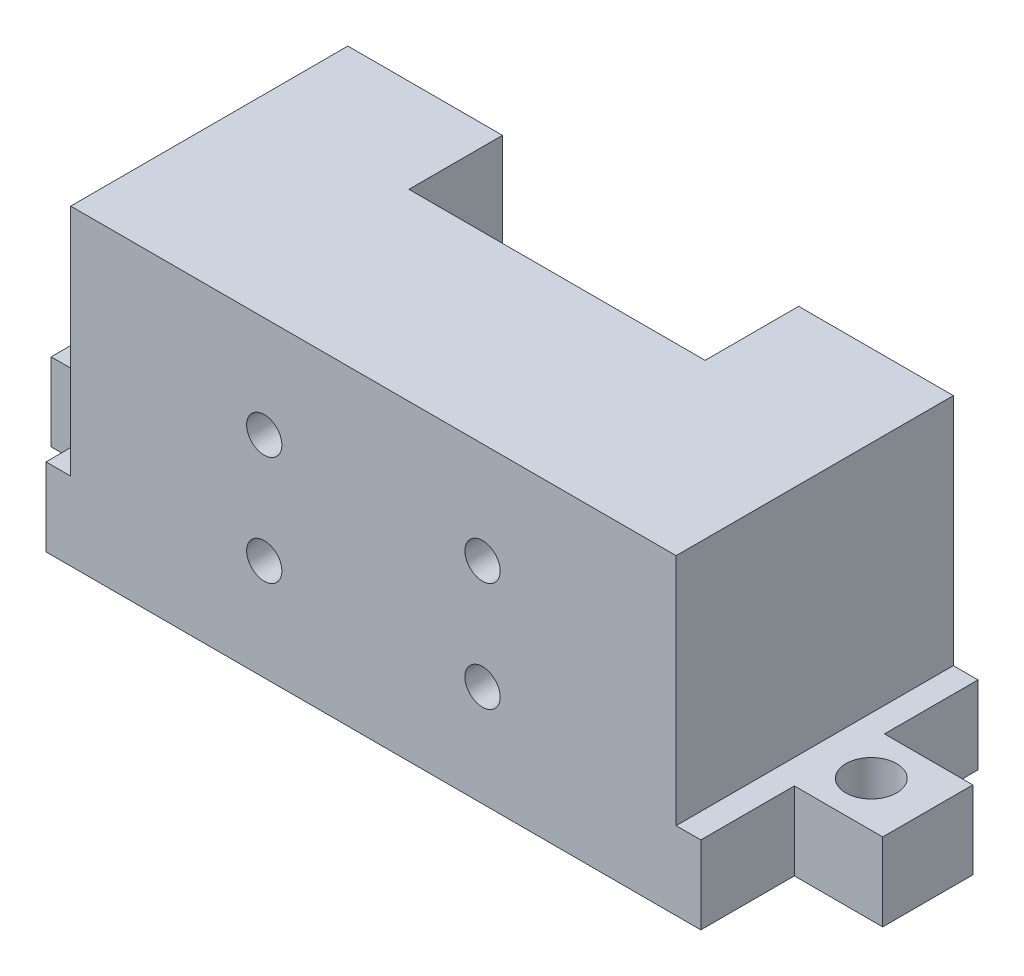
SolidWorks part; units mm, degrees
ref_plane "Front Plane" through (0, 0, 0) normal (0, 0, 1) x (1, 0, 0)
ref_plane "Top Plane" through (0, 0, 0) normal (0, 1, 0) x (1, 0, 0)
ref_plane "Right Plane" through (0, 0, 0) normal (1, 0, 0) x (0, 0, -1)
sketch "Sketch1" plane through (0, 0, 0) normal (0, 1, 0) x (1, 0, 0)
  line L1 (0, 0) -> (53.34, 0)
  line L2 (0, 0) -> (0, 17.78)
  line L3 (0, 17.78) -> (53.34, 17.78)
  line L4 (53.34, 0) -> (53.34, 17.78)
  line L5 (0, 0) -> (5.67, 0)
  line L6 (0, 0) -> (0, 6)
  line L7 (0, 6) -> (5.67, 6)
  line L8 (5.67, 0) -> (5.67, 6)
extrude "Boss-Extrude2" add sketch "Sketch1" along normal blind 20 contours L2 L3 L4 L1
sketch "Sketch3" plane through (0, 20, 0) normal (0, 1, 0) x (1, 0, 0)
  line L1 (0, 0) -> (5.67, 0)
  line L2 (0, 0) -> (0, 6)
  line L3 (0, 6) -> (5.67, 6)
  line L4 (5.67, 0) -> (5.67, 6)
  line L5 (0, 17.78) -> (5.67, 17.78)
  line L6 (0, 17.78) -> (0, 11.78)
  line L7 (0, 11.78) -> (5.67, 11.78)
  line L8 (5.67, 17.78) -> (5.67, 11.78)
  line L9 (53.34, 17.78) -> (47.673, 17.78)
  line L10 (53.34, 17.78) -> (53.34, 11.78)
  line L11 (53.34, 11.78) -> (47.673, 11.78)
  line L12 (47.673, 17.78) -> (47.673, 11.78)
  line L13 (53.34, 0) -> (47.673, 0)
  line L14 (53.34, 0) -> (53.34, 6)
  line L15 (53.34, 6) -> (47.673, 6)
  line L16 (47.673, 0) -> (47.673, 6)
extrude "Cut-Extrude1" cut sketch "Sketch3" against normal through all
sketch "Sketch4" plane through (0, 20, 0) normal (0, 1, 0) x (1, 0, 0)
  line L0 (5.67, 17.78) -> (47.673, 17.78) construction
  line L9 (17.17, 17.78) -> (36.17, 17.78)
  line L10 (17.17, 17.78) -> (17.17, 11.78)
  line L11 (17.17, 11.78) -> (36.17, 11.78)
  line L12 (36.17, 17.78) -> (36.17, 11.78)
  circle A0 centre (-4.2626, 26.7197) radius 1.6295
  circle A1 centre (51.5321, 23.1404) radius 1.6295
  point P0 (51.5321, 23.1404)
extrude "Cut-Extrude3" cut sketch "Sketch4" against normal blind 20
sketch "Sketch5" plane through (0, 20, 0) normal (0, 1, 0) x (1, 0, 0)
  line L0 (5.67, 17.78) -> (17.17, 17.78) construction
  line L1 (0, 0) -> (7.254, 0)
  line L2 (0, 0) -> (0, 17.78)
  line L3 (0, 17.78) -> (7.254, 17.78)
  line L4 (7.254, 0) -> (7.254, 17.78)
extrude "Cut-Extrude4" cut sketch "Sketch5" against normal blind 15
sketch "Sketch6" plane through (0, 20, 0) normal (0, 1, 0) x (1, 0, 0)
  line L1 (36.17, 17.78) -> (47.673, 17.78) construction
  line L2 (46.09, 17.78) -> (55, 17.78)
  line L3 (46.09, 17.78) -> (46.09, 0)
  line L4 (46.09, 0) -> (55, 0)
  line L5 (55, 17.78) -> (55, 0)
extrude "Cut-Extrude5" cut sketch "Sketch6" against normal blind 15
sketch "Sketch7" plane through (0, 5, 0) normal (0, 1, 0) x (1, 0, 0)
  circle A0 centre (3.625, 8.89) radius 1.63
  circle A1 centre (49.715, 8.89) radius 1.63
  point P2 (0, 0)
  point P3 (0, 0)
  point P4 (0, 0)
  point P7 (49.9946, 8.89)
extrude "Cut-Extrude6" cut sketch "Sketch7" against normal blind 15
sketch "Sketch8" plane through (0, 0, -11.78) normal (0, 0, -1) x (-1, 0, 0)
  circle A0 centre (-19.67, 13.5) radius 1.13
  circle A1 centre (-19.67, 6.5) radius 1.13
  circle A2 centre (-33.67, 13.5) radius 1.13
  circle A3 centre (-33.67, 6.5) radius 1.13
  point P4 (-19.67, 7.5478)
  point P7 (-33.5846, 13.5)
  point P10 (-33.67, 6.5)
extrude "Cut-Extrude7" cut sketch "Sketch8" against normal through all
